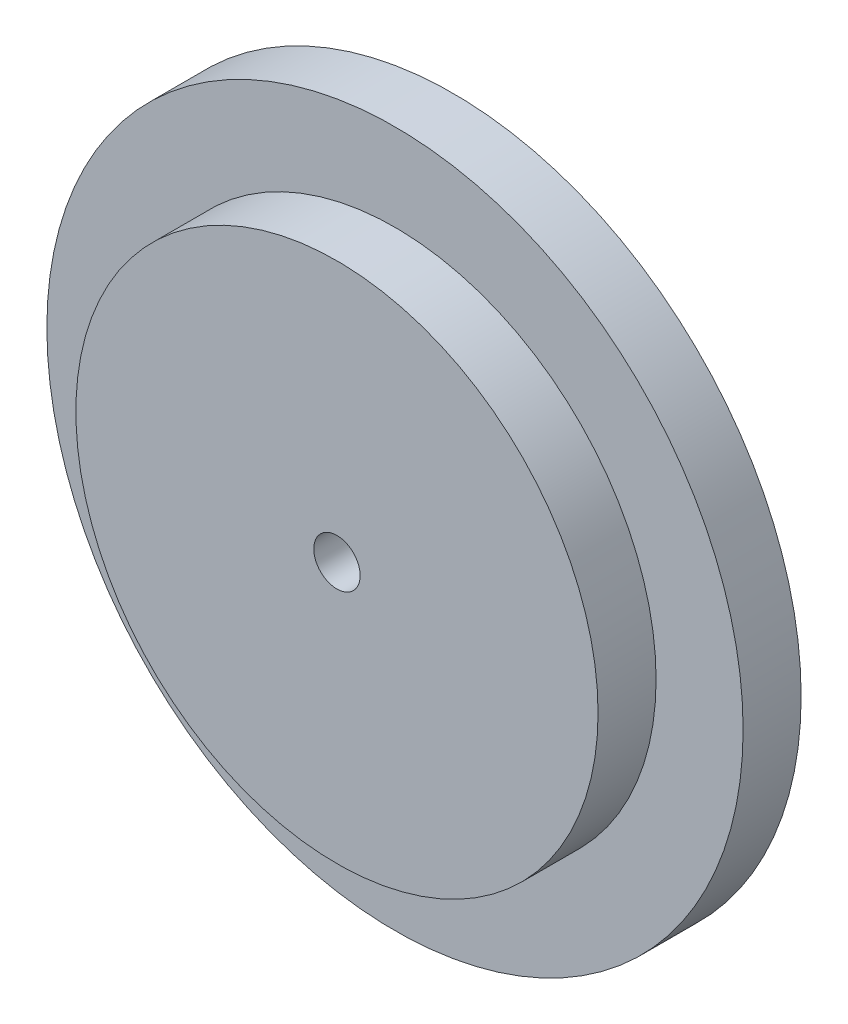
SolidWorks part; units mm, degrees
ref_plane "Front Plane" through (0, 0, 0) normal (0, 0, 1) x (1, 0, 0)
ref_plane "Top Plane" through (0, 0, 0) normal (0, 1, 0) x (1, 0, 0)
ref_plane "Right Plane" through (0, 0, 0) normal (1, 0, 0) x (0, 0, -1)
sketch "Sketch1" plane through (0, 0, 0) normal (0, 0, 1) x (1, 0, 0)
  circle A0 centre (0, 0) radius 38.1
  dimension "D1" = 76.2
extrude "Boss-Extrude1" add sketch "Sketch1" along normal blind 6.35
sketch "Sketch2" plane through (0, 0, 6.35) normal (0, 0, 1) x (1, 0, 0)
  circle A0 centre (0, 0) radius 28.575
  dimension "D1" = 57.15
extrude "Boss-Extrude2" add sketch "Sketch2" along normal blind 6.35 contours A0
sketch "Sketch3" plane through (0, 0, 12.7) normal (0, 0, 1) x (1, 0, 0)
  circle A0 centre (0, 0) radius 2.54
extrude "Cut-Extrude1" cut sketch "Sketch3" against normal through all
